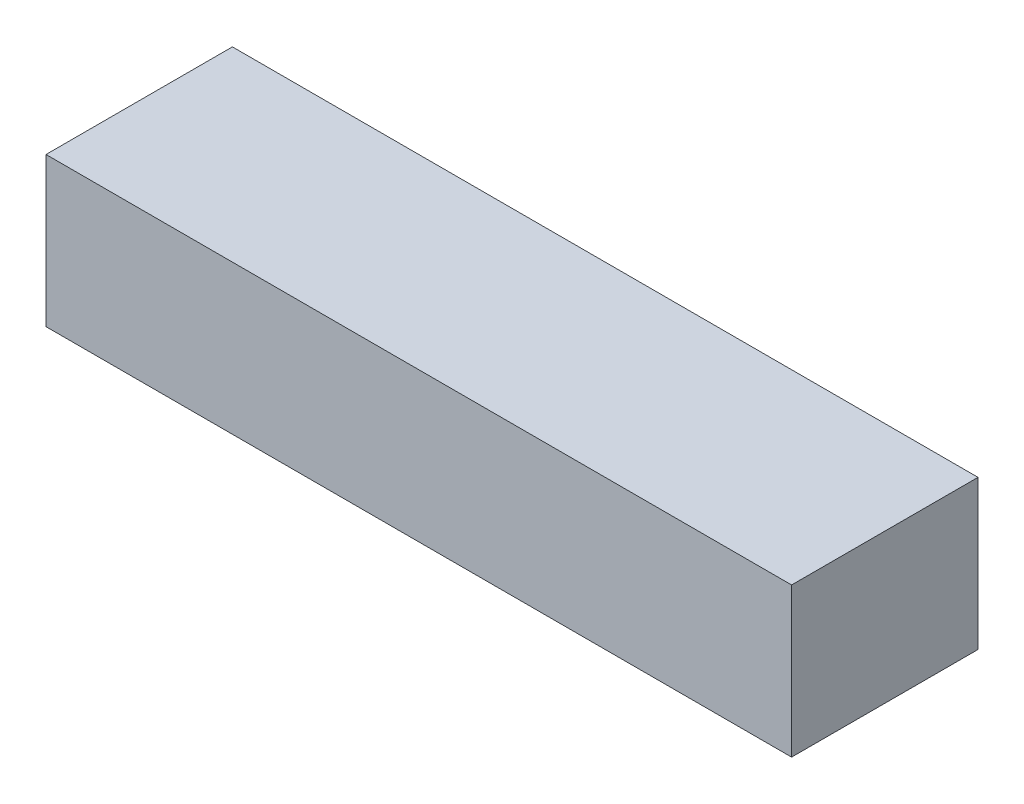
SolidWorks part; units mm, degrees
ref_plane "前视基准面" through (0, 0, 0) normal (0, 0, 1) x (1, 0, 0)
ref_plane "上视基准面" through (0, 0, 0) normal (0, 1, 0) x (1, 0, 0)
ref_plane "右视基准面" through (0, 0, 0) normal (1, 0, 0) x (0, 0, -1)
sketch "草图2" plane through (0, 0, 0) normal (0, 1, 0) x (1, 0, 0)
  line L0 (0, 0) -> (20, 0)
  line L1 (20, 0) -> (20, -5)
  line L2 (20, -5) -> (0, -5)
  line L3 (0, -5) -> (0, 0)
  dimension "D1" = 20
  dimension "D2" = 5
extrude "凸台-拉伸1" add sketch "草图2" along normal blind 4
